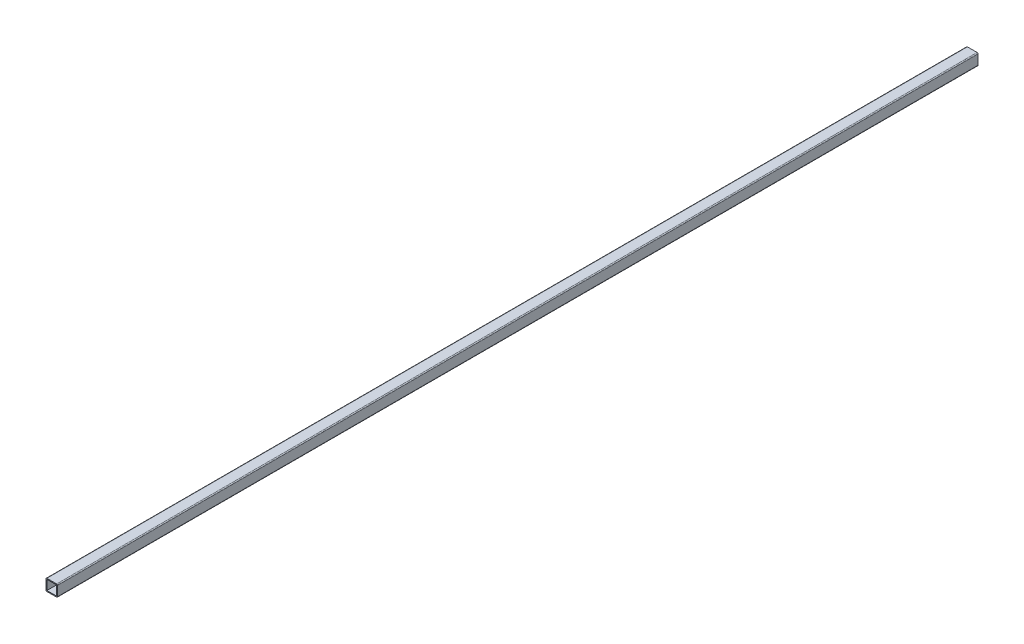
SolidWorks part; units mm, degrees
ref_plane "Спереди" through (0, 0, 0) normal (0, 0, 1) x (1, 0, 0)
ref_plane "Сверху" through (0, 0, 0) normal (0, 1, 0) x (1, 0, 0)
ref_plane "Справа" through (0, 0, 0) normal (1, 0, 0) x (0, 0, -1)
sketch "Эскиз1" plane through (0, 0, 0) normal (0, 0, 1) x (1, 0, 0)
  line L0 (-2, -2) -> (-23, -2)
  line L1 (-2, 0) -> (-23, 0)
  line L2 (0, -2) -> (0, -23)
  line L3 (-2, -25) -> (-23, -25)
  line L4 (-25, -2) -> (-25, -23)
  line L5 (-23, -2) -> (-23, -23)
  line L6 (-2, -23) -> (-23, -23)
  line L7 (-2, -2) -> (-2, -23)
  arc A0 (-23, 0) -> (-25, -2) centre (-23, -2) ccw
  arc A1 (0, -23) -> (-2, -25) centre (-2, -23) cw
  arc A2 (-23, -25) -> (-25, -23) centre (-23, -23) cw
  arc A3 (-2, 0) -> (0, -2) centre (-2, -2) cw
  arc A4 (-23, -2) -> (-23, -2) centre (-23, -2) ccw
  arc A5 (-23, -23) -> (-23, -23) centre (-23, -23) cw
  arc A6 (-2, -23) -> (-2, -23) centre (-2, -23) cw
  arc A7 (-2, -2) -> (-2, -2) centre (-2, -2) cw
  point P7 (-25, 0)
  point P10 (0, -25)
  point P15 (0, 0)
  dimension "D3" = 2
  dimension "D1" = 25
  dimension "D2" = 25
  dimension "D4" = 2
extrude "Бобышка-Вытянуть1" add sketch "Эскиз1" along normal blind 2000
